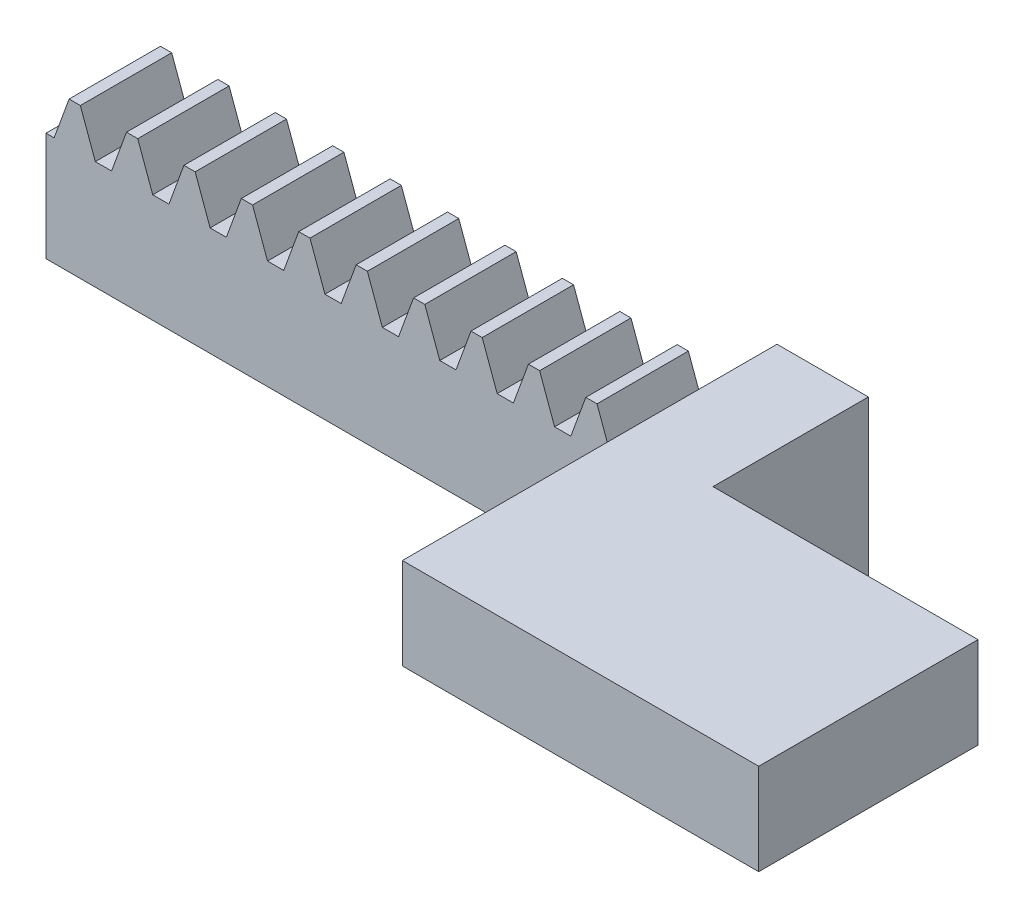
SolidWorks part; units mm, degrees
extrude "Blank" add sketch "BlankSke" against normal blind 5
sketch "BlankSke" plane through (0, 0, 0) normal (0, 0, 1) x (1, 0, 0)
  line L1 (0, 0) -> (40, 0)
  line L2 (0, 0) -> (0, 8.2)
  line L3 (0, 8.2) -> (40, 8.2)
  line L4 (40, 0) -> (40, 8.2)
ref_plane "Plane1" through (0, 0, 0) normal (0, 0, 1) x (1, 0, 0)
ref_plane "Plane2" through (0, 0, 0) normal (0, 1, 0) x (1, 0, 0)
ref_plane "Plane3" through (0, 0, 0) normal (1, 0, 0) x (0, 0, -1)
sketch "HoldingSke" plane through (0, 0, 0) normal (0, 1, 0) x (1, 0, 0)
  line L0 (0, 0) -> (0.1392, 0.9903)
  line L1 (-15, 0) -> (100, 0) construction
  line L2 (0, 0) -> (-2.1039, 2.3779)
  line L3 (0, 0) -> (-11.863, 4.5341)
  line L4 (0, 0) -> (8.3795, 2.0892)
  line L5 (0, 0) -> (-23.7986, -8.8762)
  line L6 (0, 0) -> (-10.5278, -7.1032)
  line L9 (-71.009, 38.7566) -> (-33.4213, 52.4374)
  line L10 (-76.2, 3.3779) -> (-69, 3.3779)
  line L11 (0, 0) -> (-5, 0)
  line L12 (-76.2, 101.6) -> (-76.162, 101.6)
  line L13 (24.9733, 27.94) -> (52.9518, 28.4284)
  line L14 (24.9733, 27.94) -> (24.9743, 27.94)
  line L15 (24.9733, 27.94) -> (100.4006, 29.5858)
  circle A0 centre (0, 0) radius 19.05
  circle A1 centre (0, 0) radius 3.6
  circle A2 centre (0, 0) radius 12.7
sketch "TooCutSkeIll" plane through (0, 0, 0) normal (0, 0, 1) x (1, 0, 0)
  line L0 (-1.2538, 8.1737) -> (-0.5045, 6.1152)
  line L1 (-0.2687, 5.95) -> (0.2687, 5.95)
  line L2 (0.5045, 6.1152) -> (1.2538, 8.1737)
  line L3 (40, 8.2) -> (0, 8.2) construction
  line L4 (0, 0) -> (0, 64.897) construction
  line L5 (-13.208, 7.2) -> (12.954, 7.2) construction
  line L6 (0, 0) -> (40, 0) construction
  line L7 (0.8994, 7.2) -> (0.8994, 48.7463) construction
  line L8 (-0.8994, 7.2) -> (-0.8994, 48.7463) construction
  line L9 (1.2914, 8.2) -> (1.2914, 8.2254)
  line L10 (-1.2914, 8.2) -> (-1.2914, 8.2254)
  line L11 (-1.2914, 8.2254) -> (1.2914, 8.2254)
  arc A0 (0.2687, 5.95) -> (0.5045, 6.1152) centre (0.2687, 6.201) ccw
  arc A1 (-0.5045, 6.1152) -> (-0.2687, 5.95) centre (-0.2687, 6.201) ccw
  arc A2 (1.2914, 8.2) -> (1.2538, 8.1737) centre (1.2914, 8.16) ccw
  arc A3 (-1.2538, 8.1737) -> (-1.2914, 8.2) centre (-1.2914, 8.16) ccw
extrude "ToothCutIll" [suppressed] cut sketch "TooCutSkeIll" against normal through all
sketch "TooCutSkeSim" plane through (0, 0, 0) normal (0, 0, 1) x (1, 0, 0)
  line L0 (0.4444, 5.95) -> (-0.4444, 5.95)
  line L1 (1.2726, 8.2254) -> (0.4444, 5.95)
  line L2 (0, 17.4625) -> (0, 53.467) construction
  line L3 (1.2726, 8.2254) -> (-1.2726, 8.2254)
  line L6 (-1.2726, 8.2254) -> (-0.4444, 5.95)
  line L9 (-0.8994, 7.2) -> (0.8994, 7.2) construction
  line L10 (0, 0) -> (40, 0) construction
  line L11 (0.8994, 7.2) -> (0.8994, 53.467) construction
  line L12 (-0.8994, 7.2) -> (-0.8994, 53.467) construction
extrude "ToothCutSim" cut sketch "TooCutSkeSim" against normal through all
pattern_linear "TeethCuts" count 13 spacing 3.1416 along (1, 0, 0) of "ToothCutIll", "ToothCutSim"
sketch "Sketch1" plane through (0, 0, 0) normal (0, 0, 1) x (1, 0, 0)
  line L0 (35.002, 5.95) -> (40, 5.95)
  line L1 (40, 0) -> (40, 7.0387) construction
  line L2 (40, 5.95) -> (40, 8.2)
  line L3 (40, 8.2) -> (35.002, 8.2)
  line L4 (35.002, 8.2) -> (35.002, 5.95)
extrude "Boss-Extrude1" add sketch "Sketch1" against normal blind 5
sketch "Sketch3" plane through (0, 0, 0) normal (0, 0, 1) x (1, 0, 0)
  line L1 (35.002, 5.95) -> (40, 5.95)
  line L2 (35.002, 5.95) -> (35.002, 8.2)
  line L3 (35.002, 8.2) -> (40, 8.2)
  line L4 (40, 5.95) -> (40, 8.2)
extrude "Boss-Extrude2" add sketch "Sketch3" along normal blind 15.5
sketch "Sketch4" plane through (40, 0, 0) normal (1, 0, 0) x (0, 0, -1)
  line L0 (-15.5, 5.95) -> (0, 5.95) construction
  line L1 (-15.5, 8.2) -> (-3.5, 8.2)
  line L2 (-15.5, 8.2) -> (-15.5, 5.95)
  line L3 (-15.5, 5.95) -> (-3.5, 5.95)
  line L4 (-3.5, 8.2) -> (-3.5, 5.95)
  dimension "D1" = 12
extrude "Boss-Extrude4" add sketch "Sketch4" along normal blind 14.5
sketch "Sketch6" plane through (0, 8.2, 0) normal (0, 1, 0) x (1, 0, 0)
  line L0 (35.002, 5) -> (35.002, -15.5)
  line L1 (35.002, -15.5) -> (54.5, -15.5)
  line L2 (54.5, -15.5) -> (54.5, -3.5)
  line L3 (54.5, -3.5) -> (40, -3.5)
  line L4 (40, -3.5) -> (40, 5)
  line L5 (40, 5) -> (35.002, 5)
extrude "Boss-Extrude5" add sketch "Sketch6" along normal blind 2.75
equation "' \"Module@HoldingSke\" = 6.35"
equation "' \"Num_teeth@HoldingSke\" = 12"
equation "' \"Ap@HoldingSke\" =  20"
equation "' \"Ap@HoldingSke\" = 20"
equation "' \"Width@HoldingSke\" = 0.25 * 25.4"
equation "' \"Show_teeth@HoldingSke\" = 500"
equation "' \"Backlash@HoldingSke\" = 0.009 * 25.4"
equation "' \"Addendum_fac@HoldingSke\" = 1.0"
equation "' \"Dedendum_fac@HoldingSke\" = 1.25"
equation "' \"Dedendum_add@HoldingSke\" = 0.00005 * 25.4"
equation "' \"Clearance_fac@HoldingSke\" = 0.25"
equation "' \"Pitch_height@HoldingSke\" = 1 * 25.4"
equation "' \"Length@HoldingSke\" = 4.71 * 25.4"
equation "\"Pitch@HoldingSke\" = 1 / \"Module@HoldingSke\""
equation "\"MPH@HoldingSke\" = \"Dedendum_fac@HoldingSke\" / \"Pitch@HoldingSke\" + 2 * \"Dedendum_add@HoldingSke\" + 0.002 * 25.4"
equation "\"MPH@HoldingSke\" = ((sgn( \"MPH@HoldingSke\" - \"Pitch_height@HoldingSke\")+1)*( \"MPH@HoldingSke\" - \"Pitch_height@HoldingSke\"))/2 + \"Pitch_height@HoldingSke\""
equation "\"Blank_height@BlankSke\" = \"Pitch_height@HoldingSke\" + \"Addendum_fac@HoldingSke\"  / \"Pitch@HoldingSke\" "
equation "\"Length@BlankSke\" =  \"Length@HoldingSke\""
equation "\"Face_width@Blank\" = \"Width@HoldingSke\""
equation "\"Pressure_angle@TooCutSkeIll\" = \"Ap@HoldingSke\""
equation "\"Addendum_plus@TooCutSkeIll\" =  \"Addendum_fac@HoldingSke\"  / \"Pitch@HoldingSke\" + 0.001 *25.4"
equation "\"Dedendum@TooCutSkeIll\" = \"Dedendum_fac@HoldingSke\"  / \"Pitch@HoldingSke\""
equation "\"Pitch_height@TooCutSkeIll\" =  \"MPH@HoldingSke\""
equation "\"Gap_width@TooCutSkeIll\" = 3.14159265 / 2 / \"Pitch@HoldingSke\" + 6 * \"Backlash@HoldingSke\""
equation "\"Pressure_angle@TooCutSkeSim\" = \"Ap@HoldingSke\""
equation "\"Addendum_plus@TooCutSkeSim\" =  \"Addendum_fac@HoldingSke\"  / \"Pitch@HoldingSke\" + 0.001 * 25.4"
equation "\"Dedendum@TooCutSkeSim\" = \"Dedendum_fac@HoldingSke\"  / \"Pitch@HoldingSke\""
equation "\"Pitch_height@TooCutSkeSim\" =  \"MPH@HoldingSke\""
equation "\"Gap_width@TooCutSkeSim\" = 3.14159265 / 2 / \"Pitch@HoldingSke\" + 6 * \"Backlash@HoldingSke\""
equation "\"Root_fillet@TooCutSkeIll\" = \"Clearance_fac@HoldingSke\" / \"Pitch@HoldingSke\" + \"Dedendum_add@HoldingSke\""
equation "\"Break_rad@TooCutSkeIll\" = 0.02 / \"Pitch@HoldingSke\" * 2"
equation "\"Linear_pitch@TeethCuts\" = 3.14159265 / \"Pitch@HoldingSke\""
equation "\"Num_teeth@HoldingSke\" = int( ( \"Length@HoldingSke\" + 0 ) / (3.14159265 / \"Pitch@HoldingSke\")) + 0.9999  + 1"
equation " \"Num_teeth@TeethCuts\" = int( \"Show_teeth@HoldingSke\" ) + 1"
equation " \"Num_teeth@TeethCuts\" = ((sgn( \"Num_teeth@TeethCuts\" - \"Num_teeth@HoldingSke\" )-1)*( \"Num_teeth@TeethCuts\" - \"Num_teeth@HoldingSke\" ))/-2+ \"Num_teeth@HoldingSke\""
equation " \"Num_teeth@TeethCuts\" = ((sgn( \"Num_teeth@TeethCuts\" - 2.0)+1)*( \"Num_teeth@TeethCuts\" - 2.0))/2 +2.0"
